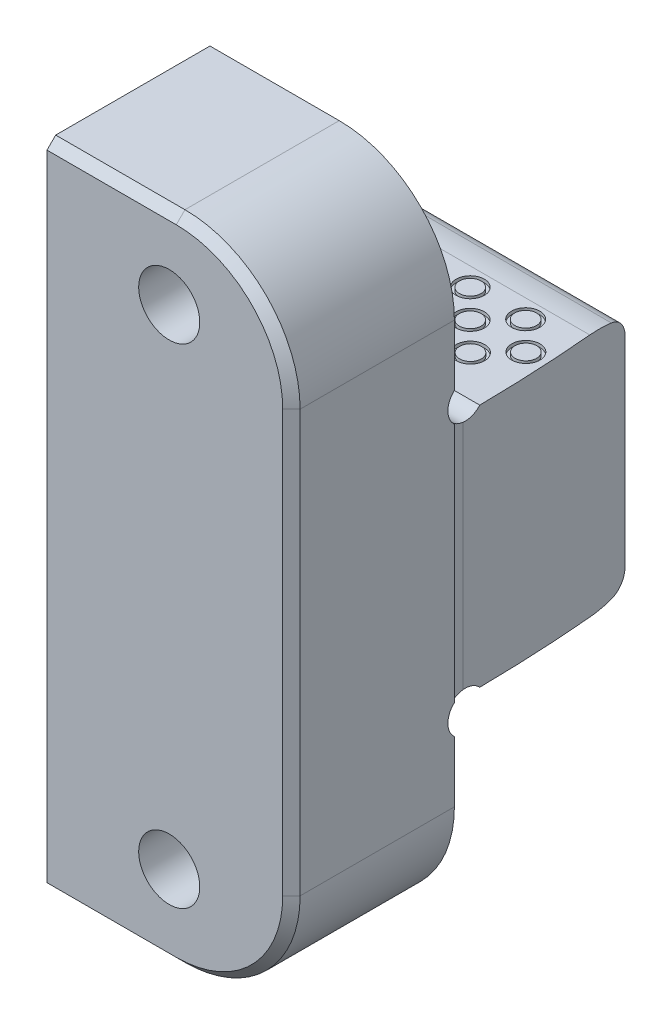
SolidWorks part; units mm, degrees
ref_plane "Front Plane" through (0, 0, 0) normal (0, 0, 1) x (1, 0, 0)
ref_plane "Top Plane" through (0, 0, 0) normal (0, 1, 0) x (1, 0, 0)
ref_plane "Right Plane" through (0, 0, 0) normal (1, 0, 0) x (0, 0, -1)
sketch "Sketch3" plane through (0, 0, 0) normal (1, 0, 0) x (0, 0, -1)
  line L0 (0, 15.7163) -> (0, -15.7163) construction
  line L1 (-19.05, -38.1) -> (0, -38.1)
  line L2 (-19.05, -38.1) -> (-19.05, 38.1)
  line L3 (-19.05, 38.1) -> (0, 38.1)
  line L4 (21.336, -14.285) -> (21.336, 14.285)
  line L6 (0, -38.1) -> (0, -14.285)
  line L7 (0, -14.285) -> (21.336, -14.285)
  line L8 (0, 38.1) -> (0, 14.285)
  line L9 (0, 14.285) -> (21.336, 14.285)
  line L10 (0, 0) -> (50000, 0) construction
  dimension "D1" = 40.386
  dimension "D2" = 19.05
  dimension "D3" = 76.2
  dimension "D4" = 28.5699
extrude "Extrude1" add sketch "Sketch3" along normal mid plane 28.575
sketch "Sketch7" plane through (14.2875, 0, 0) normal (1, 0, 0) x (0, 0, -1)
  line L1 (0, -14.5526) -> (21.9683, -14.5526)
  line L2 (0, -14.5526) -> (0, 17.1683)
  line L3 (0, 17.1683) -> (21.9683, 17.1683)
  line L4 (21.9683, -14.5526) -> (21.9683, 17.1683)
  line L5 (0, -38.1) -> (0, -14.285) construction
extrude "Cut-Extrude3" cut sketch "Sketch7" against normal blind 0.254
sketch "Sketch8" plane through (14.2875, 0, 0) normal (1, 0, 0) x (0, 0, -1)
  line L0 (0, 0) -> (50000, 0) construction
  line L1 (0, -38.1) -> (0, 38.1) construction
  line L2 (0, 14.285) -> (21.336, 14.285) construction
  circle A0 centre (1.524, 15.809) radius 2.286
  circle A1 centre (1.524, -15.809) radius 2.286
  dimension "D1" = 2.286
  dimension "D2" = 0.762
  dimension "D3" = 0.762
extrude "Cut-Extrude4" cut sketch "Sketch8" against normal through all
sketch "Sketch9" plane through (14.2875, 0, 0) normal (1, 0, 0) x (0, 0, -1)
  line L0 (3.2279, 14.285) -> (21.336, 14.285) construction
  line L1 (21.336, 14.285) -> (21.336, -14.285) construction
  line L2 (0, 0) -> (50000, 0) construction
  line L3 (21.336, 11.745) -> (23.114, 11.745)
  line L4 (16.764, 14.285) -> (16.764, 18.095)
  line L5 (16.764, 18.095) -> (23.114, 18.095)
  line L6 (23.114, 11.745) -> (23.114, 18.095)
  line L7 (23.114, -11.745) -> (23.114, -18.095)
  line L8 (16.764, -18.095) -> (23.114, -18.095)
  line L9 (16.764, -14.285) -> (16.764, -18.095)
  line L10 (21.336, -11.745) -> (23.114, -11.745)
  arc A0 (16.764, 14.285) -> (19.5518, 13.9752) centre (16.764, 1.585) cw
  arc A1 (19.5518, 13.9752) -> (21.336, 11.745) centre (19.05, 11.745) cw
  arc A2 (19.5518, -13.9752) -> (21.336, -11.745) centre (19.05, -11.745) ccw
  arc A3 (16.764, -14.285) -> (19.5518, -13.9752) centre (16.764, -1.585) ccw
  dimension "D1" = 2.286
  dimension "D2" = 12.7
  dimension "D3" = 4.572
  dimension "D4" = 6.35
  dimension "D5" = 6.35
extrude "Cut-Extrude5" cut sketch "Sketch9" against normal through all
sketch "Sketch13" plane through (0, 38.1, 0) normal (0, 1, 0) x (1, 0, 0)
  line L0 (14.0335, 3.2279) -> (14.0335, 16.764) construction
  line L2 (12.2099, 26.67) -> (24.9099, 26.67)
  line L4 (14.0335, 1.27) -> (24.9099, 1.27)
  line L5 (24.9099, 26.67) -> (24.9099, 1.27)
  arc A0 (12.2099, 26.67) -> (14.0335, 1.27) centre (-163.7665, 1.27) cw
  dimension "D1" = 177.8
  dimension "D2" = 1.27
  dimension "D3" = 25.4
  dimension "D4" = 12.7
extrude "Cut-Extrude6" cut sketch "Sketch13" against normal through all
sketch "Sketch15" plane through (0, 14.285, 0) normal (0, 1, 0) x (1, 0, 0)
  line L0 (14.2875, -19.05) -> (-14.2875, -19.05) construction
  line L1 (-14.2875, 16.764) -> (-14.2875, 3.2279) construction
  line L2 (-14.2875, 0) -> (-14.2875, -19.05) construction
  circle A0 centre (-4.9403, 14.605) radius 1.651
  circle A1 centre (-4.9403, 14.605) radius 1.27
  circle A2 centre (1.5367, 14.605) radius 1.651
  circle A3 centre (1.5367, 14.605) radius 1.27
  circle A4 centre (-11.4173, 14.605) radius 1.651
  circle A5 centre (-11.4173, 14.605) radius 1.27
  circle A6 centre (8.0137, 14.605) radius 1.651
  circle A7 centre (8.0137, 14.605) radius 1.27
  circle A12 centre (-1.6637, 11.303) radius 1.651
  circle A13 centre (-1.6637, 11.303) radius 1.27
  circle A14 centre (4.8387, 11.303) radius 1.651
  circle A15 centre (4.8387, 11.303) radius 1.27
  circle A16 centre (-8.1661, 11.303) radius 1.651
  circle A17 centre (-8.1661, 11.303) radius 1.27
  circle A18 centre (11.3411, 11.303) radius 1.651
  circle A19 centre (11.3411, 11.303) radius 1.27
  circle A24 centre (-4.8895, 8.001) radius 1.651
  circle A25 centre (-4.8895, 8.001) radius 1.27
  circle A26 centre (1.6383, 8.001) radius 1.651
  circle A27 centre (1.6383, 8.001) radius 1.27
  circle A28 centre (-11.4173, 8.001) radius 1.651
  circle A29 centre (-11.4173, 8.001) radius 1.27
  circle A30 centre (8.1661, 8.001) radius 1.651
  circle A31 centre (8.1661, 8.001) radius 1.27
  dimension "D1" = 33.655
  dimension "D2" = 2.8702
  dimension "D12" = 6.5278
  dimension "D7" = 3.302
  dimension "D8" = 2.54
  dimension "D3" = 6.1214
  dimension "D4" = 6.477
  dimension "D5" = 6.477
  dimension "D6" = 6.477
  dimension "D9" = 6.5024
  dimension "D10" = 6.5024
  dimension "D11" = 6.5024
  dimension "D13" = 6.5278
  dimension "D14" = 6.5278
  dimension "D15" = 3.302
  dimension "D16" = 3.302
extrude "Cut-Extrude7" cut sketch "Sketch15" against normal blind 0.381
mirror "Mirror1" about plane through (0, 0, 0) normal (0, 1, 0) of "Cut-Extrude7"
hole_wizard "1/4\"-20 CBORE" positions "Sketch11" profile "Sketch10" counterbore size "1/4" standard "Ansi Inch"
sketch "Sketch11" plane through (0, 0, 0) normal (0, 0, -1) x (-1, 0, 0)
  line L0 (0, 0) -> (0, 50000) construction
  line L1 (0, 0) -> (50000, 0) construction
  point P0 (0, 28.575)
  point P10 (0, -28.575)
  dimension "D1" = 57.15
sketch "Sketch10" plane through (0, 28.575, 0) normal (1, 0, 0) x (0, 1, 0)
  line L0 (0, 0) -> (0, 19.05)
  line L1 (0, 19.05) -> (3.5712, 19.05)
  line L3 (3.5712, 19.05) -> (3.5712, 7.145)
  line L4 (3.5712, 7.145) -> (5.5562, 7.145)
  line L5 (5.5562, 7.145) -> (5.5562, 0)
  line L7 (5.5562, 0) -> (0, 0)
  line L11 (0, -6.35) -> (0, 107.95) construction
  dimension "Thru Hole Dia." = 7.1425
  dimension "Thru Hole Depth" = 19.05
  dimension "C'Bore Dia." = 11.1125
  dimension "C'Bore Depth" = 7.145
fillet "Fillet1" radius 13.462 2 edges at (14.2875, -38.1, 9.525) (14.2875, 38.1, 9.525)
chamfer "Chamfer1" distance 1.016 angle 45 5 edges at (-6.731, 38.1, 19.05) (-6.731, -38.1, 19.05) (14.2875, 0, 19.05) (10.3446, 34.1571, 19.05) (10.3446, -34.1571, 19.05)
